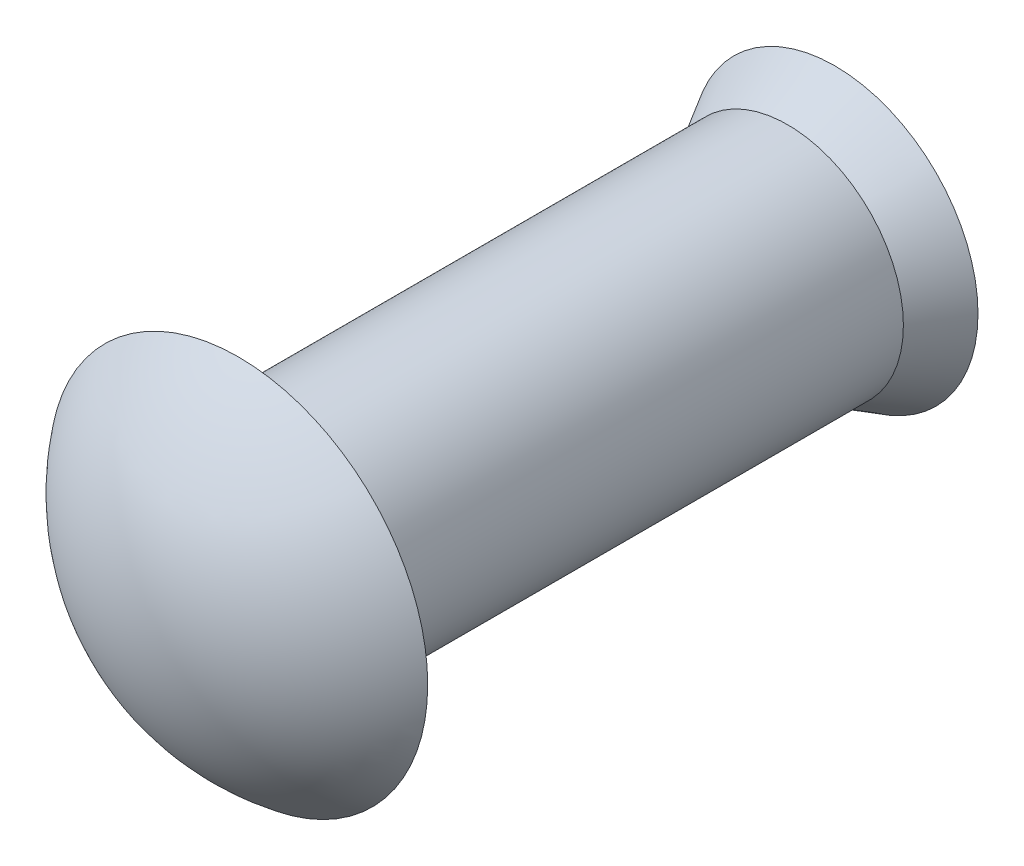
SolidWorks part; units mm, degrees
ref_plane "Спереди" through (0, 0, 0) normal (0, 0, 1) x (1, 0, 0)
ref_plane "Сверху" through (0, 0, 0) normal (0, 1, 0) x (1, 0, 0)
ref_plane "Справа" through (0, 0, 0) normal (1, 0, 0) x (0, 0, -1)
sketch "Эскиз1" plane through (0, 0, 0) normal (1, 0, 0) x (0, 0, -1)
  line L0 (0, 0) -> (45.7845, 0) construction
  line L1 (1.5875, 3.175) -> (1.5875, 1.9431)
  line L2 (1.5875, 1.9431) -> (10.8026, 1.9431)
  line L3 (10.8026, 1.9431) -> (11.5964, 2.4014)
  line L4 (11.5964, 2.4014) -> (11.5964, 0)
  line L5 (11.5964, 0) -> (0, 0)
  arc A0 (0, 0) -> (1.5875, 3.175) centre (3.9688, 0) cw
  dimension "D2" = 3.9688
  dimension "D1" = 6.35
  dimension "D3" = 30
  dimension "D4" = 0.7937
  dimension "D5" = 3.8862
  dimension "D6" = 9.2151
revolve "Повернуть1" add sketch "Эскиз1" angle 360 about L0
